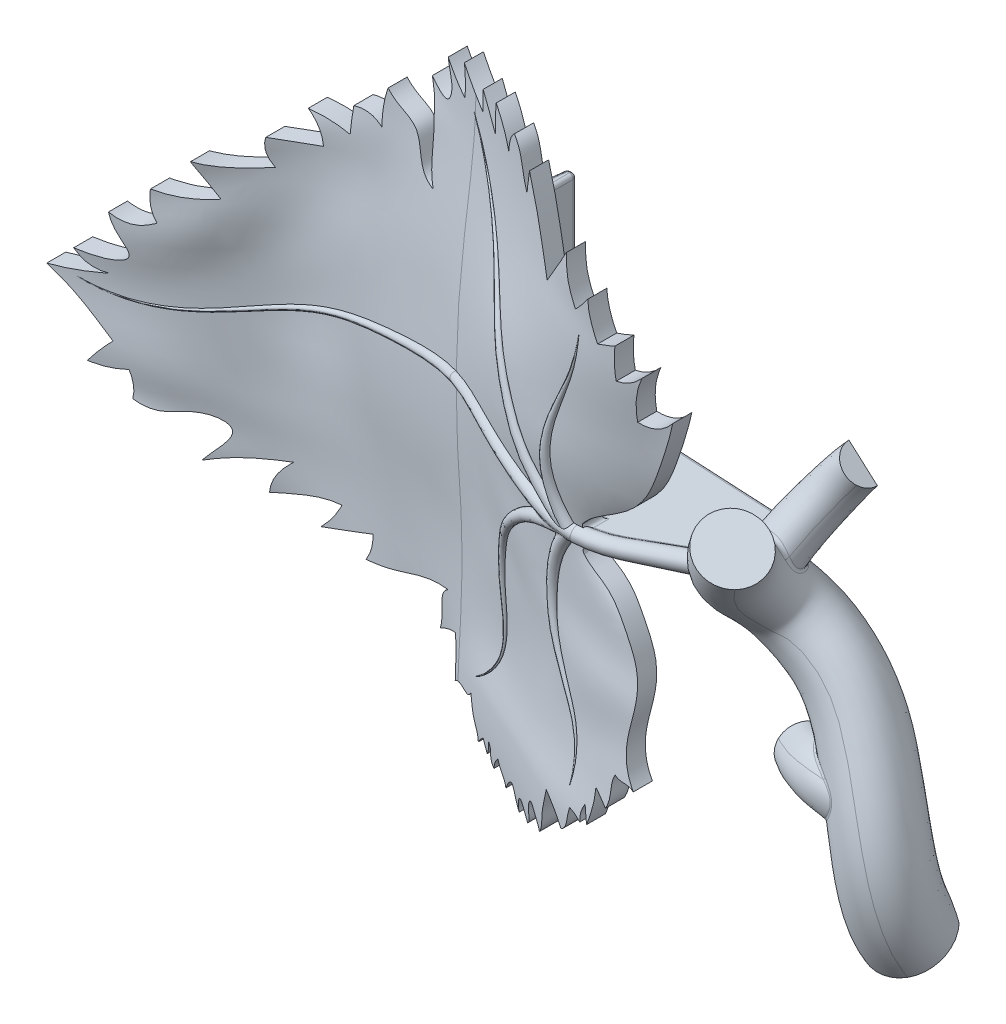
SolidWorks part; units mm, degrees
ref_plane "Plan de face" through (0, 0, 0) normal (0, 0, 1) x (1, 0, 0)
ref_plane "Plan de dessus" through (0, 0, 0) normal (0, 1, 0) x (1, 0, 0)
ref_plane "Plan de droite" through (0, 0, 0) normal (1, 0, 0) x (0, 0, -1)
imported_body "Importée3"
draft "Dépouille1" type of draft neutral plane draft angle 0.724 faces to draft 1 parameters "D1"=0.724
draft "Dépouille2" type of draft neutral plane draft angle 33.608 faces to draft 1 parameters "D1"=33.608
draft "Dépouille3" type of draft neutral plane draft angle 3 faces to draft 5 parameters "D1"=3
fillet "Congé1" radius 1 24 edges at (58.961, 0.6583, -1.4436) (87.3782, -36.4591, -17.4611) (95.8507, -46.9289, -8.2676) (42.8634, -1.5006, 1.3539) (37.0091, 1.8526, 1.0684) (14.5641, -26.9808, -8.3172) (14.1489, -53.5079, -16.2402) (10.5087, -19.9326, -9.7072) (14.7475, 15.3366, -4.8174) (78.2677, -1.8304, -25) (13.6898, 26.4386, -25) (45.5072, 0.9516, -25) (14.1025, 50.6709, -17.1245) (45.4516, -1.1756, -25) (13.6898, -26.28, -25) (14.1889, 0.2963, -15.4776) (12.5, 50.2582, -25) (10.9485, 50.6199, -18.0977) (12.5, -53.0488, -25) (11.3102, -1.3953, -25) (10.8971, -53.4619, -17.1177) (14.1955, 2.7613, -15.3514)
fillet "Congé2" radius 0.5 2 edges at (40.2469, -2.0724, 6.24) (40.619, -1.8003, 7.1419)
fillet "Congé3" radius 0.5 4 edges at (44.3357, -1.9184, 6.5888) (43.4859, -0.8972, 8.082) (41.8499, -0.8799, 7.9553) (35.8603, -0.2607, 6.7831)
